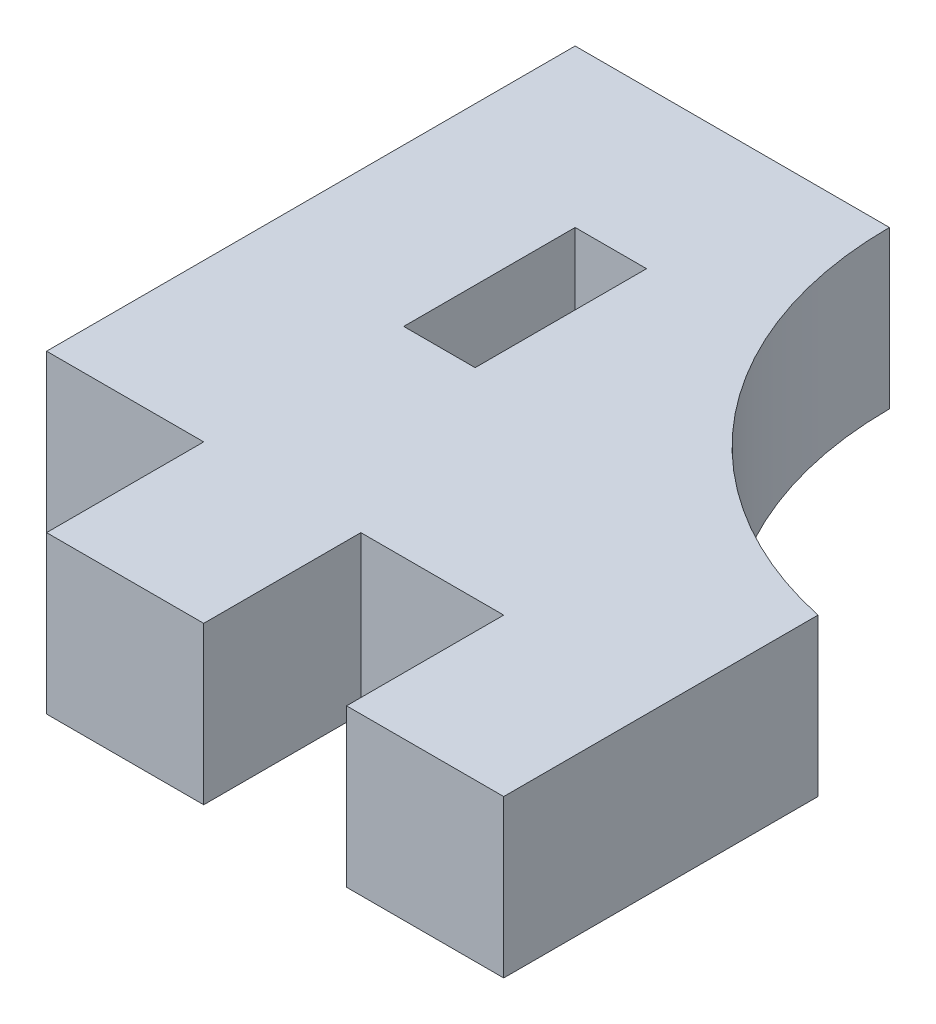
SolidWorks part; units mm, degrees
ref_plane "Front Plane" through (0, 0, 0) normal (0, 0, 1) x (1, 0, 0)
ref_plane "Top Plane" through (0, 0, 0) normal (0, 1, 0) x (1, 0, 0)
ref_plane "Right Plane" through (0, 0, 0) normal (1, 0, 0) x (0, 0, -1)
sketch "Sketch1" plane through (0, 0, 0) normal (0, 1, 0) x (1, 0, 0)
  line L0 (0, 0) -> (-16, 0) construction
  line L1 (-16, 0) -> (-16, 5.5) construction
  line L2 (-16, 5.5) -> (0, 5.5) construction
  line L3 (0, 5.5) -> (0, 0) construction
  line L4 (0, 0) -> (-5.5, 0) construction
  line L5 (-5.5, 0) -> (-5.5, 5.5) construction
  line L6 (-16, 5.5) -> (-10.5, 5.5) construction
  line L7 (-10.5, 5.5) -> (-10.5, 0) construction
  line L8 (-16, 5.5) -> (-16, 15.5) construction
  line L9 (-16, 5.5) -> (-21.5, 5.5) construction
  line L10 (-21.5, 5.5) -> (-21.5, 24) construction
  line L11 (-21.5, 24) -> (-5.5, 24) construction
  line L12 (-5.5, 24) -> (-5.5, 11) construction
  line L13 (-5.5, 11) -> (0, 11) construction
  line L14 (0, 11) -> (0, 5.5) construction
  line L15 (-16, 18.5) -> (-16, 12.5) construction
  line L16 (-16, 12.5) -> (-13.5, 12.5) construction
  line L17 (-13.5, 12.5) -> (-13.5, 18.5) construction
  line L18 (-13.5, 18.5) -> (-16, 18.5) construction
  line L19 (-10.5, 24) -> (-10.5, 11) construction
  line L20 (-10.5, 11) -> (-5.5, 11) construction
  line L23 (-10.5, 24) -> (-21.5, 24)
  line L24 (-21.5, 24) -> (-21.5, 5.5)
  line L25 (-21.5, 5.5) -> (-16, 5.5)
  line L26 (-16, 5.5) -> (-16, 0)
  line L27 (-16, 0) -> (-10.5, 0)
  line L28 (-10.5, 0) -> (-10.5, 5.5)
  line L29 (-10.5, 5.5) -> (-5.5, 5.5)
  line L30 (-5.5, 5.5) -> (-5.5, 0)
  line L31 (-5.5, 0) -> (0, 0)
  line L32 (0, 0) -> (0, 5.5)
  line L33 (0, 5.5) -> (0, 11)
  line L34 (-16, 18.5) -> (-13.5, 18.5)
  line L35 (-13.5, 18.5) -> (-13.5, 12.5)
  line L36 (-13.5, 12.5) -> (-16, 12.5)
  line L37 (-16, 12.5) -> (-16, 18.5)
  arc A0 (-10.5, 24) -> (0, 11) centre (2.7976, 24) ccw
  point P16 (-16, 15.5)
  dimension "D2" = 6
  dimension "D3" = 18.5
  dimension "D1" = 2.5
extrude "Boss-Extrude1" add sketch "Sketch1" along normal blind 5.5
